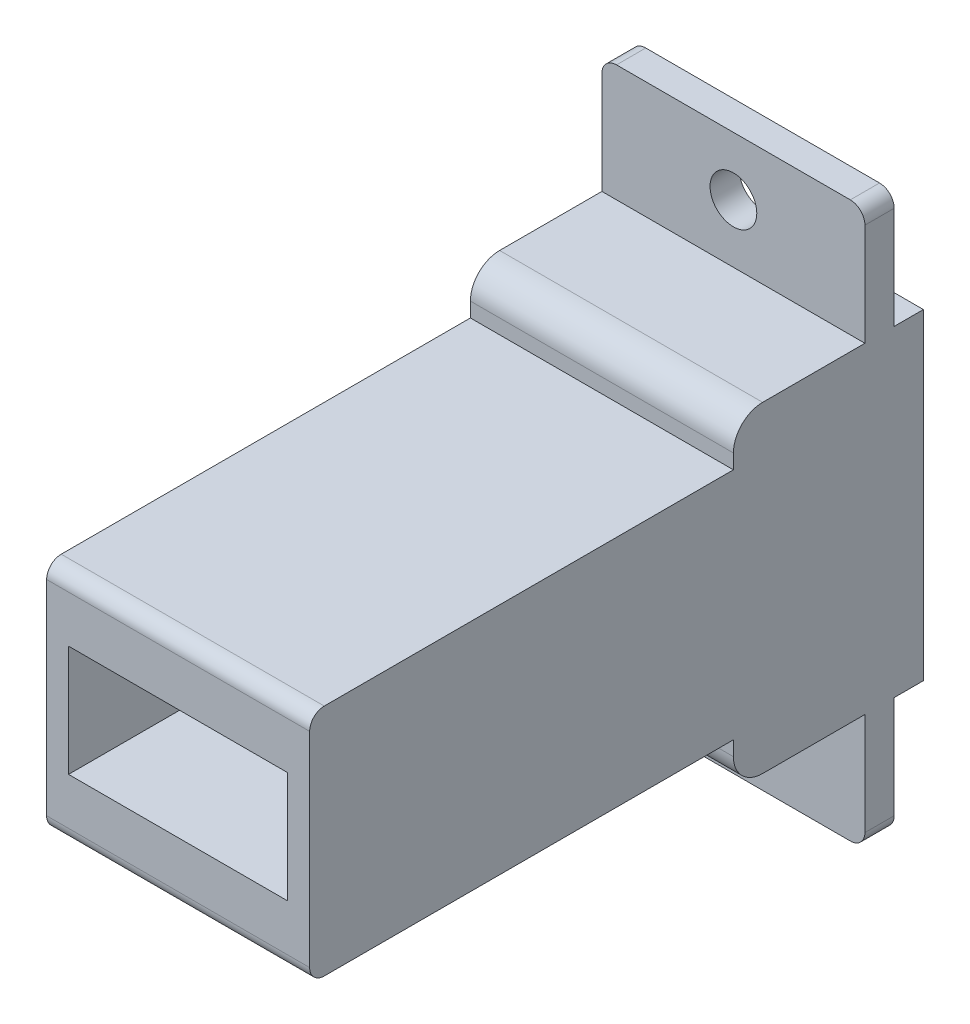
SolidWorks part; units mm, degrees
ref_plane "Front Plane" through (0, 0, 0) normal (0, 0, 1) x (1, 0, 0)
ref_plane "Top Plane" through (0, 0, 0) normal (0, 1, 0) x (1, 0, 0)
ref_plane "Right Plane" through (0, 0, 0) normal (1, 0, 0) x (0, 0, -1)
sketch "Sketch1" plane through (0, 0, 0) normal (0, 0, 1) x (1, 0, 0)
  line L0 (0, 19) -> (0, -19) construction
  line L1 (-9, -19) -> (9, -19)
  line L2 (-9, -19) -> (-9, 19)
  line L3 (-9, 19) -> (9, 19)
  line L4 (9, -19) -> (9, 19)
  line L5 (-9, -19) -> (9, 19) construction
  line L6 (-9, 19) -> (9, -19) construction
  circle A0 centre (0, 15) radius 1.6
  circle A1 centre (0, -15) radius 1.6
  point P0 (0, 0)
  dimension "D3" = 3.2
  dimension "D4" = 3.2
  dimension "D1" = 18
  dimension "D2" = 38
  dimension "D5" = 15
  dimension "D6" = 15
extrude "Boss-Extrude1" add sketch "Sketch1" along normal blind 2
fillet "Fillet1" radius 1 4 edges at (9, -19, 1) (-9, -19, 1) (-9, 19, 1) (9, 19, 1)
sketch "Sketch2" plane through (0, 0, 0) normal (1, 0, 0) x (0, 0, -1)
  line L0 (-2, 11) -> (-9, 11)
  line L1 (-2, 18) -> (-2, -18) construction
  line L2 (-2, -11) -> (-9, -11)
  line L3 (-2, -18) -> (-2, 18) construction
  line L4 (-11, 8) -> (-39, 8)
  line L5 (-11, 9) -> (-11, 8)
  line L6 (-11, -8) -> (-39, -8)
  line L7 (-40, 7) -> (-40, -7)
  line L8 (-11, -8) -> (-11, -9)
  line L9 (-2, 11) -> (-2, -11)
  arc A0 (-9, -11) -> (-11, -9) centre (-9, -9) cw
  arc A1 (-9, 11) -> (-11, 9) centre (-9, 9) ccw
  arc A2 (-39, -8) -> (-40, -7) centre (-39, -7) cw
  arc A3 (-39, 8) -> (-40, 7) centre (-39, 7) ccw
  point P6 (-2, 0)
  point P9 (-2, 0)
  point P12 (-2, 0)
  point P15 (-2, 0)
  point P20 (-11, 11)
  point P25 (-40, 8)
  dimension "D7" = 2
  dimension "D8" = 1
  dimension "D1" = 9
  dimension "D2" = 11
  dimension "D3" = 11
  dimension "D4" = 29
  dimension "D5" = 8
  dimension "D6" = 8
extrude "Boss-Extrude2" add sketch "Sketch2" along normal mid plane 18
sketch "Sketch3" plane through (0, 0, 40) normal (0, 0, 1) x (1, 0, 0)
  line L1 (-7.5, -3.8) -> (7.5, -3.8)
  line L2 (-7.5, -3.8) -> (-7.5, 3.8)
  line L3 (-7.5, 3.8) -> (7.5, 3.8)
  line L4 (7.5, -3.8) -> (7.5, 3.8)
  line L5 (-7.5, -3.8) -> (7.5, 3.8) construction
  line L6 (-7.5, 3.8) -> (7.5, -3.8) construction
  point P0 (0, 0)
  dimension "D1" = 15
  dimension "D2" = 7.6
extrude "Cut-Extrude1" cut sketch "Sketch3" against normal blind 15
sketch "Sketch4" plane through (0, 0, 0) normal (1, 0, 0) x (0, 0, -1)
  line L0 (0, 11) -> (2, 11)
  line L1 (0, -18) -> (0, 18) construction
  line L2 (2, 11) -> (2, -11)
  line L3 (2, -11) -> (0, -11)
  line L4 (0, -11) -> (0, 11)
  dimension "D1" = 11
  dimension "D2" = 11
  dimension "D3" = 2
extrude "Boss-Extrude3" add sketch "Sketch4" along normal mid plane 18
